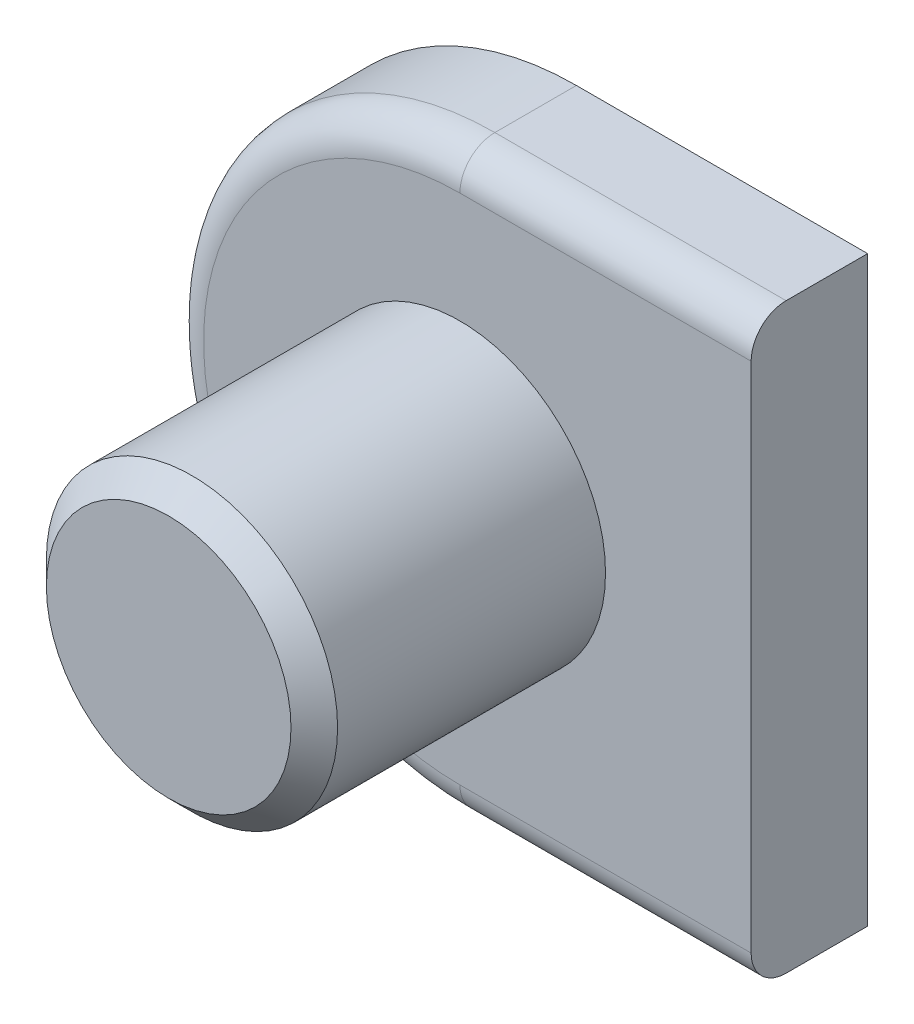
SolidWorks part; units mm, degrees
ref_plane "Front Plane" through (0, 0, 0) normal (0, 0, 1) x (1, 0, 0)
ref_plane "Top Plane" through (0, 0, 0) normal (0, 1, 0) x (1, 0, 0)
ref_plane "Right Plane" through (0, 0, 0) normal (1, 0, 0) x (0, 0, -1)
sketch "Sketch4" plane through (0, 0, 0) normal (0, 0, 1) x (1, 0, 0)
  line L1 (12.5, -25) -> (-12.5, -25)
  line L2 (12.5, -25) -> (12.5, 25)
  line L3 (12.5, 25) -> (-12.5, 25)
  line L4 (-12.5, -25) -> (-12.5, 25) construction
  line L5 (12.5, -25) -> (-12.5, 25) construction
  line L6 (12.5, 25) -> (-12.5, -25) construction
  arc A0 (-12.5, 25) -> (-12.5, -25) centre (-12.5, 0) ccw
  point P0 (0, 0)
  dimension "D1" = 25
  dimension "D2" = 50
extrude "Boss-Extrude1" add sketch "Sketch4" along normal blind 10
sketch "Sketch5" plane through (0, 0, 10) normal (0, 0, 1) x (1, 0, 0)
  circle A0 centre (-12.5, 0) radius 12.5
  dimension "D1" = 25
extrude "Boss-Extrude2" add sketch "Sketch5" along normal blind 25
fillet "Fillet1" radius 3 3 edges at (0, 25, 10) (0, -25, 10) (-37.5, 0, 10)
chamfer "Chamfer1" distance 2 angle 45 1 edges at (0, 0, 35)
sketch "Sketch6" plane through (0, 0, 10) normal (0, 0, 1) x (1, 0, 0)
  line L0 (0, 17.2973) -> (9.5889, -1.1214)
  point P2 (3.2681, -14.7146)
sketch "Sketch7" plane through (12.5, 0, 0) normal (1, 0, 0) x (0, 0, -1)
  arc A0 (-3.1578, -12.4717) -> (-3.9054, 14.9865) centre (22.1115, 1.9556) cw
